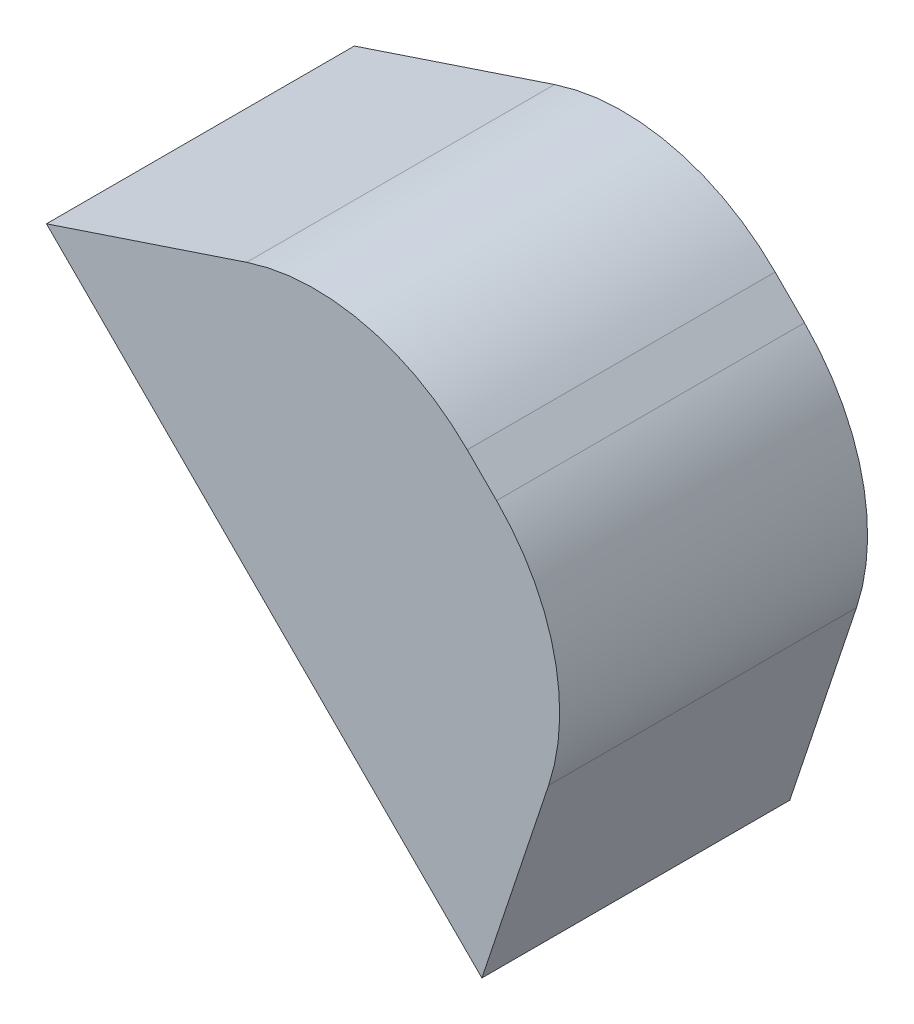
SolidWorks part; units mm, degrees
ref_plane "正面" through (0, 0, 0) normal (0, 0, 1) x (1, 0, 0)
ref_plane "平面" through (0, 0, 0) normal (0, 1, 0) x (1, 0, 0)
ref_plane "右側面" through (0, 0, 0) normal (1, 0, 0) x (0, 0, -1)
sketch "ｽｹｯﾁ1" plane through (0, 0, 0) normal (0, 0, 1) x (1, 0, 0)
  line L0 (7.0711, 7.0711) -> (0, 0) construction
  line L1 (-7.0711, 7.0711) -> (3.5355, 10.6066)
  line L2 (-7.0711, 7.0711) -> (7.0711, -7.0711)
  line L3 (7.0711, -7.0711) -> (10.6066, 3.5355)
  line L4 (3.5355, 10.6066) -> (10.6066, 3.5355)
  dimension "D1" = 20
  dimension "D2" = 10
  dimension "D3" = 10
extrude "ﾎﾞｽ - 押し出し1" add sketch "ｽｹｯﾁ1" along normal blind 10
fillet "ﾌｨﾚｯﾄ1" radius 7
move or copy body "ﾎﾞﾃﾞｨ-ﾒｯｼｭ ﾎﾞﾃﾞｨに変換1" bodies to move or copy 101 copy no translate (0, 0, 0)
fillet "ﾌｨﾚｯﾄ2" radius 7
